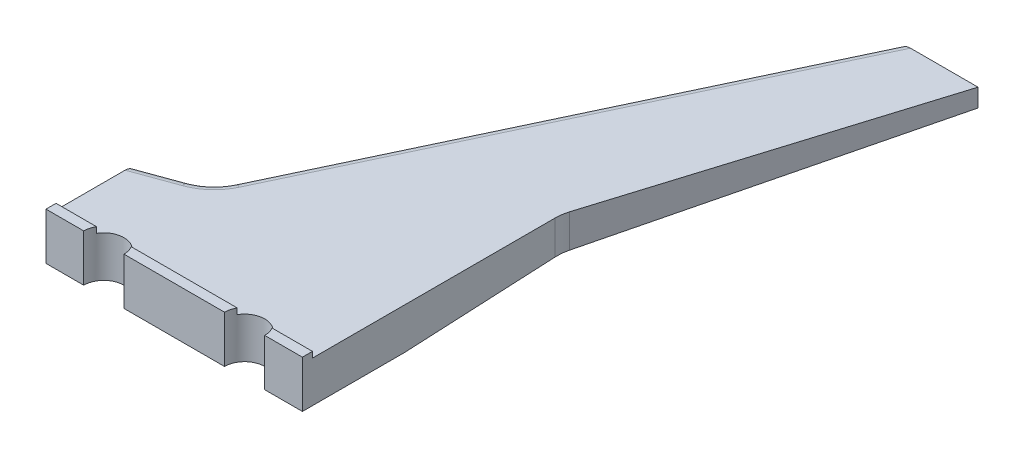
SolidWorks part; units mm, degrees
ref_plane "Plan de face" through (0, 0, 0) normal (0, 0, 1) x (1, 0, 0)
ref_plane "Plan de dessus" through (0, 0, 0) normal (0, 1, 0) x (1, 0, 0)
ref_plane "Plan de droite" through (0, 0, 0) normal (1, 0, 0) x (0, 0, -1)
sketch "Esquisse1" plane through (0, 0, 0) normal (0, 1, 0) x (1, 0, 0)
  line L0 (0, 0) -> (51, 0)
  line L1 (51, 0) -> (51, 33.7)
  line L2 (51, 33.7) -> (70.5168, 97)
  line L4 (54.8814, 97) -> (11, 4.0037)
  line L5 (11, 4.0037) -> (0, 0)
  line L6 (54.8814, 97) -> (70.5168, 97)
  dimension "D2" = 33.7
  dimension "D3" = 11
  dimension "D4" = 20
  dimension "D5" = 51
  dimension "D6" = 15.6354
  dimension "D7" = 97
  dimension "D8" = 64.739
  dimension "D9" = 72.864
  dimension "D11" = 19.5168
extrude "Boss.-Extru.1" add sketch "Esquisse1" along normal blind 8.2
fillet "Congé1" radius 8.5 2 edges at (51, 4.1, -33.7) (11, 4.1, -4.0037)
sketch "Esquisse5" plane through (0, 8.2, 0) normal (0, 1, 0) x (1, 0, 0)
  line L0 (62.6991, 97) -> (25.5, 0) construction
  line L2 (0, 0) -> (51, 0) construction
  line L3 (70.5168, 97) -> (54.8814, 97) construction
ref_plane "Plan3" through (22.2306, 0, 8.5253) normal (-0.9337, 0, -0.3581) x (-0.3581, 0, 0.9337)
sketch "Esquisse6" plane through (22.2306, 0, 8.5253) normal (-0.9337, 0, -0.3581) x (-0.3581, 0, 0.9337)
  line L0 (-113.019, 0) -> (-113.019, 4.5) construction
  line L2 (-15, 8.2) -> (-15, 0) construction
  line L3 (-113.019, 8.2) -> (-9.1307, 8.2) construction
  line L4 (-110.2197, 0) -> (-11.1654, 0) construction
  line L5 (-218.019, 9.3205) -> (-15, 0)
  line L6 (-15, 0) -> (90, 0)
  line L7 (0, 8.2) -> (0, 0) construction
  line L8 (-115.8183, 0) -> (-110.2197, 0) construction
  dimension "D1" = 4.5
  dimension "D2" = 105
  dimension "D3" = 105
  dimension "D4" = 15
  dimension "D5" = 2.629
ref_plane "Plan4" through (0, 9.3205, 0) normal (0, 1, 0) x (-1, 0, 0)
sketch "Esquisse7" plane through (0, 9.3205, 0) normal (0, 1, 0) x (-1, 0, 0)
  line L0 (-100.2962, -195.038) -> (-118.1997, -241.7228) construction
  line L1 (-100.2962, -195.038) -> (-27.6016, -5.4801) construction
  circle A0 centre (-118.1997, -241.7228) radius 50
  dimension "D1" = 100
sweep "Enlèvement de matière-Balayage3" cut profiles "Esquisse7" path "Esquisse6"
sketch "Esquisse8" plane through (0, 0, 0) normal (0, 0, 1) x (1, 0, 0)
  line L4 (0, 0) -> (51, 0)
  line L5 (51, 0) -> (51, 8.2)
  line L6 (51, 8.2) -> (0, 8.2)
  line L7 (0, 8.2) -> (0, 0)
  line L8 (0, 0) -> (51, 0)
  line L9 (51, 0) -> (51, 8.2)
  line L10 (51, 8.2) -> (0, 8.2)
  line L11 (0, 8.2) -> (0, 0)
  dimension "D1" = 0
extrude "Boss.-Extru.2" add sketch "Esquisse8" along normal blind 11
fillet "Congé3" radius 2 1 edges at (0, 4.1, 0)
sketch "Esquisse14" plane through (0, 0, 0) normal (0, -1, 0) x (1, 0, 0)
  line L0 (12.1651, -28.5) -> (43, -28.5) construction
  line L1 (12.1651, -26) -> (43, -26)
  line L2 (12.1651, -31) -> (43, -31)
  line L3 (0, 11) -> (51, 11) construction
  line L4 (51, -32.4194) -> (51, -2.4677) construction
  arc A0 (12.1651, -26) -> (12.1651, -31) centre (12.1651, -28.5) ccw
  arc A1 (43, -31) -> (43, -26) centre (43, -28.5) ccw
  point P2 (27.5825, -28.5)
  dimension "D1" = 2.5
  dimension "D3" = 8
  dimension "D2" = 39.5
extrude "Enlèv. mat.-Extru.2" cut sketch "Esquisse14" against normal blind 4
fillet "Congé4" radius 1 3 edges at (33.3693, 4, -31) (45.5, 4, -28.5) (32.1896, 4, -26)
fillet "Congé5" radius 2 3 edges at (4.5144, 8.2, -1.6431) (10.5339, 8.2, -4.5147) (33.6871, 8.2, -52.0837)
sketch "Esquisse15" plane through (0, 0, -97) normal (0, 0, -1) x (-1, 0, 0)
  line L0 (-57.8814, 1.5969) -> (-57.8814, 6.5969)
  line L1 (-57.8814, 6.5969) -> (-64.8814, 6.5969)
  line L2 (-64.8814, 6.5969) -> (-64.8814, 1.5969)
  line L3 (-54.8814, 6.2) -> (-54.8814, 4.3469) construction
  line L4 (-64.8814, 1.5969) -> (-57.8814, 1.5969)
  dimension "D1" = 3
  dimension "D2" = 7
  dimension "D3" = 5
  dimension "D4" = 2.25
extrude "Enlèv. mat.-Extru.3" cut sketch "Esquisse15" against normal blind 10
fillet "Congé6" radius 3.5 2 edges at (64.8814, 5.3448, -87) (57.8814, 5.2943, -87)
sketch "Esquisse16" plane through (0, 0, 0) normal (-1, 0, 0) x (0, 0, 1)
  line L5 (11, 8.2) -> (11, 0)
  line L6 (11, 0) -> (17.8509, 0)
  line L7 (17.8509, 0) -> (17.8509, 9.3556)
  line L8 (17.8509, 9.3556) -> (15.8509, 9.3556)
  line L9 (15.8509, 9.3556) -> (15.8509, 8.2)
  line L10 (11, 8.2) -> (15.8509, 8.2)
extrude "Boss.-Extru.3" add sketch "Esquisse16" against normal up to surface (51 mm away)
sketch "Esquisse17" plane through (0, 0, 0) normal (0, -1, 0) x (1, 0, 0)
  line L0 (51, 17.8509) -> (0, 17.8509) construction
  line L1 (0, 17.8509) -> (0, 1.4004) construction
  circle A0 centre (11.5, 17.8509) radius 4
  circle A1 centre (39.5, 17.8509) radius 4
  dimension "D1" = 8
  dimension "D2" = 8
  dimension "D3" = 11.5
  dimension "D4" = 28
extrude "Enlèv. mat.-Extru.4" cut sketch "Esquisse17" against normal through all
sketch "Trajectoire Fraise diam. 100" plane through (22.2306, 0, 8.5253) normal (-0.9337, 0, -0.3581) x (-0.3581, 0, 0.9337)
  line L0 (-218.019, 9.3205) -> (-15, 0) construction
  line L1 (-15, 0) -> (90, 0) construction
  line L2 (-218.019, 9.3205) -> (-15, 0) construction
  line L3 (-15, 0) -> (90, 0) construction
  line L4 (-175.8183, 5.0876) -> (-65, 0)
  line L5 (-65, 0) -> (76.6673, 0)
  line L6 (16.6673, 0) -> (16.6673, 9.3556) construction
  line L7 (-175.8183, 14.8789) -> (-175.8183, -22.4728) construction
  line L8 (-115.8183, 8.2) -> (-115.8183, 4.6039) construction
  dimension "D1" = 50
  dimension "D2" = 60
  dimension "D3" = 60
